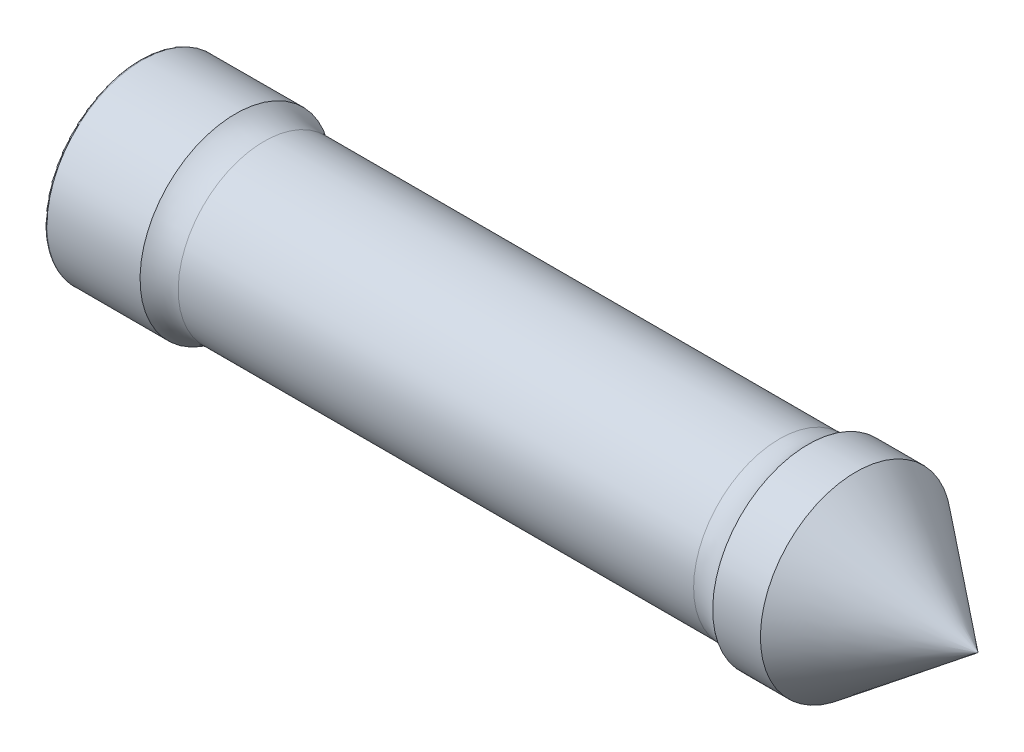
SolidWorks part; units mm, degrees
ref_plane "Front Plane" through (0, 0, 0) normal (0, 0, 1) x (1, 0, 0)
ref_plane "Top Plane" through (0, 0, 0) normal (0, 1, 0) x (1, 0, 0)
ref_plane "Right Plane" through (0, 0, 0) normal (1, 0, 0) x (0, 0, -1)
sketch "Sketch1" plane through (0, 0, 0) normal (0, 0, 1) x (1, 0, 0)
  line L0 (0, 0) -> (150, 0) construction
  line L1 (0, 0) -> (0, 20)
  line L2 (0, 20) -> (150, 20) construction
  line L3 (150, 20) -> (175.5663, 0.0254)
  line L4 (150, 0) -> (175, 0) construction
  line L5 (0, 0) -> (175.5663, 0)
  line L6 (0, 20) -> (20, 20)
  line L7 (75, 20) -> (75, 673.9612) construction
  line L8 (20, 20) -> (20, 18)
  line L9 (20, 18) -> (140, 18)
  line L10 (140, 18) -> (140, 20)
  line L11 (140, 20) -> (150, 20)
  line L12 (175.5663, 0.0254) -> (175.5663, 0)
  point P11 (20, 19)
  dimension "D2" = 2
  dimension "D4" = 20
  dimension "D5" = 75
  dimension "D6" = 10
  dimension "D1" = 150
  dimension "D3" = 40
  dimension "D7" = 25
  dimension "D8" = 0.0254
  dimension "D9" = 38
revolve "Revolve1" add sketch "Sketch1" angle 360 about L5
hole_wizard "Ø30 Diameter Hole1" positions "Sketch3" profile "Sketch4" hole size "Ø25.0" standard "ANSI Metric"
sketch "Sketch3" plane through (0, 0, 0) normal (-1, 0, 0) x (0, 0, 1)
  point P0 (0, 0)
sketch "Sketch4" plane through (0, 0, 0) normal (0, 1, 0) x (0, 0, 1)
  line L0 (0, 0) -> (0, 159.0129)
  line L1 (0, 159.0129) -> (15, 150)
  line L2 (15, 150) -> (15, 1)
  line L3 (15, 1) -> (16, 0)
  line L5 (16, 0) -> (0, 0)
  line L6 (-15, 1) -> (-16, 0) construction
  line L10 (0, 159.0129) -> (-15, 150) construction
  line L11 (0, -6.35) -> (0, 107.95) construction
  dimension "Hole Dia." = 30
  dimension "Hole Depth" = 150
  dimension "Near C'Sink Dia." = 32
  dimension "Near C'Sink Angle" = 90
  dimension "Drill Angle" = 118
fillet "Fillet2" radius 0.5 1 edges at (0, -20, 0)
fillet "Fillet3" radius 10 2 edges at (140, -18, 0) (20, -18, 0)
ref_plane "Plane1" through (0, -20, 0) normal (0, -1, 0) x (-1, 0, 0)
hole_wizard "M4x0.7 Tapped Hole1" positions "Sketch5" profile "Sketch6" tap size "M4x0.7" standard "ANSI Metric"
sketch "Sketch5" plane through (0, -20, 0) normal (0, -1, 0) x (-1, 0, 0)
  line L0 (0, 0) -> (-150, 0) construction
  line L2 (-150, -20) -> (-150, 20) construction
  line L4 (0, -16) -> (0, 16) construction
  point P7 (-13.97, 0)
  dimension "D1" = 13.97
sketch "Sketch6" plane through (13.97, -20, 0) normal (1, 0, 0) x (0, 0, -1)
  line L0 (0, 0) -> (0, 5)
  line L1 (0, 5) -> (1.65, 5)
  line L2 (1.65, 5) -> (1.65, 0.375)
  line L3 (1.65, 0.375) -> (2.025, 0)
  line L5 (2.025, 0) -> (0, 0)
  line L6 (-1.65, 0.375) -> (-2.025, 0) construction
  line L11 (0, -6.35) -> (0, 107.95) construction
  dimension "Thru Tap Drill Dia." = 3.3
  dimension "Thru Tap Drill Depth" = 5
  dimension "Near C'Sink Dia." = 4.05
  dimension "Near C'Sink Angle" = 90
sketch "Sketch7" plane through (0, -20, 0) normal (0, 1, 0) x (-1, 0, 0)
  line L0 (0, 0) -> (-150, 0) construction
  line L2 (-150, 20) -> (-150, -20) construction
  line L6 (-35.052, 2.5) -> (-124.6, 2.5)
  line L9 (-35.052, -2.5) -> (-124.6, -2.5)
  arc A3 (-124.6, 2.5) -> (-124.6, -2.5) centre (-124.6, 0) ccw
  arc A4 (-35.052, 2.5) -> (-35.052, -2.5) centre (-35.052, 0) cw
  dimension "D2" = 35.052
  dimension "D3" = 2.5
  dimension "D1" = 25.4
  dimension "D5" = 5
extrude "Cut-Extrude1" [suppressed] cut sketch "Sketch7" along normal offset from surface (4.1965 mm away) 2
chamfer "Chamfer1" [suppressed] distance 0.5 angle 45
pattern_circular "CirPattern1" [suppressed] count 6 over 360
sketch "Sketch8" [suppressed] plane through (0, -20, 0) normal (0, -1, 0) x (-1, 0, 0)
  line L0 (0, 0) -> (-150, 0) construction
  line L1 (-42.418, -17.5) -> (-42.418, 17.5) construction
  line L2 (-49.918, -17.5) -> (-49.918, 17.5)
  line L3 (-34.918, -17.5) -> (-34.918, 17.5)
  line L4 (-150, -20) -> (-150, 20) construction
  line L5 (0, -16) -> (0, 16) construction
  arc A0 (-49.918, -17.5) -> (-34.918, -17.5) centre (-42.418, -17.5) ccw
  arc A1 (-34.918, 17.5) -> (-49.918, 17.5) centre (-42.418, 17.5) ccw
  point P6 (-42.418, 0)
  dimension "D1" = 10
  dimension "D2" = 42.418
  dimension "D3" = 30
wrap "Wrap1" [suppressed] sketch "Sketch8" source sketch "Sketch8" thickness 2 parameters "D1"=2
fillet "Fillet4" [suppressed] radius 0.25
pattern_linear "LPattern2" [suppressed] count 4 spacing 25
move or copy body "Body-Move/Copy1" [suppressed] bodies to move or copy 115 copy no rotation origin (0, 0, 0) rotation axis (1, 0, 0) rotation angle 90
